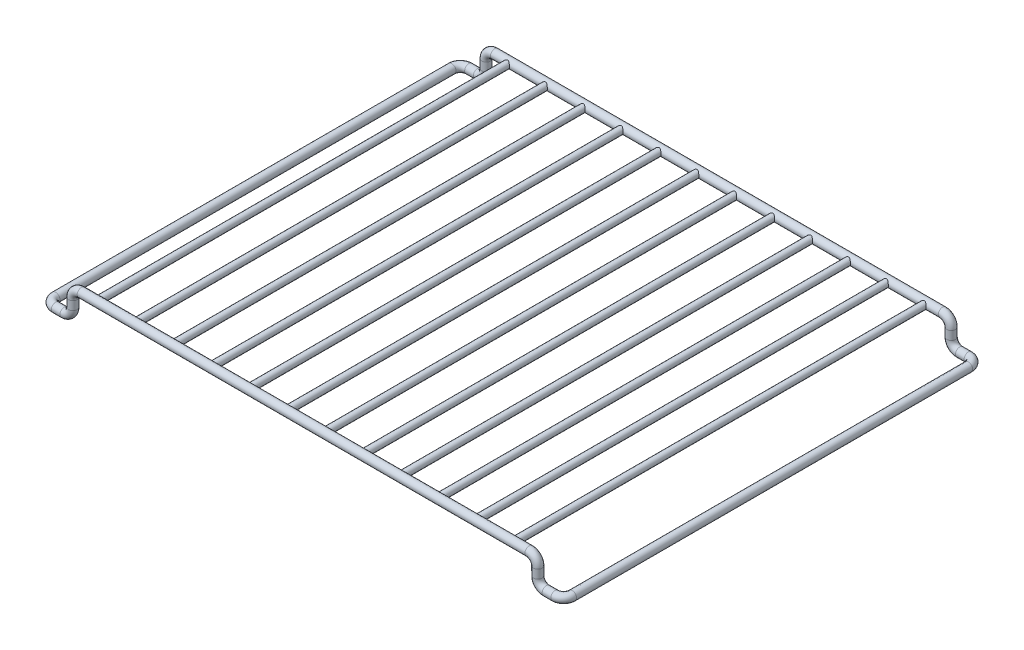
SolidWorks part; units mm, degrees
ref_plane "Front Plane" through (0, 0, 0) normal (0, 0, 1) x (1, 0, 0)
ref_plane "Top Plane" through (0, 0, 0) normal (0, 1, 0) x (1, 0, 0)
ref_plane "Right Plane" through (0, 0, 0) normal (1, 0, 0) x (0, 0, -1)
sketch3d "3DSketch1"
  line L0 (0, 0, 0) -> (130, 0, 0)
  line L1 (135, -5, 0) -> (135, -10, 0)
  line L2 (140, -15, 0) -> (145, -15, 0)
  line L3 (150, -15, -5) -> (150, -15, -235)
  line L4 (145, -15, -240) -> (140, -15, -240)
  line L5 (135, -10, -240) -> (135, -5, -240)
  line L6 (130, 0, -240) -> (0, 0, -240)
  arc A0 (130, 0, 0) -> (135, -5, 0) centre (130, -5, 0) ccw
  arc A1 (135, -10, 0) -> (140, -15, 0) centre (140, -10, 0) ccw
  arc A2 (145, -15, 0) -> (150, -15, -5) centre (145, -15, -5) ccw
  arc A3 (150, -15, -235) -> (145, -15, -240) centre (145, -15, -235) ccw
  arc A4 (140, -15, -240) -> (135, -10, -240) centre (140, -10, -240) ccw
  arc A5 (135, -5, -240) -> (130, 0, -240) centre (130, -5, -240) ccw
  point P11 (135, 0, 0)
  point P12 (130, -5, -5)
  point P15 (135, -15, 0)
  point P16 (140, -10, 5)
  point P19 (150, -15, 0)
  point P20 (145, -10, -5)
  point P23 (150, -15, -240)
  point P24 (145, -10, -235)
  point P27 (135, -15, -240)
  point P28 (140, -10, -245)
  point P31 (135, 0, -240)
  point P32 (130, -5, -235)
  dimension "D8" = 5
  dimension "D1" = 135
  dimension "D2" = 15
  dimension "D3" = 15
  dimension "D4" = 240
  dimension "D7" = 15
  dimension "D5" = 15
  dimension "D6" = 135
sketch "Sketch1" plane through (0, 0, 0) normal (1, 0, 0) x (0, 0, -1)
  circle A0 centre (0, 0) radius 2.5
  dimension "D1" = 5
sweep "Sweep1" add profiles "Sketch1" path "3DSketch1"
sketch "Sketch2" plane through (0, 0, 0) normal (0, 0, 1) x (1, 0, 0)
  circle A0 centre (11, 0) radius 2
  dimension "D1" = 11
  dimension "D2" = 4
extrude "Extrude1" add sketch "Sketch2" against normal up to surface (237.5 mm away)
pattern_linear "LPattern1" count 6 spacing 22 along (1, 0, 0) of "Extrude1"
mirror "Mirror1" about plane through (0, 0, 0) normal (1, 0, 0)
